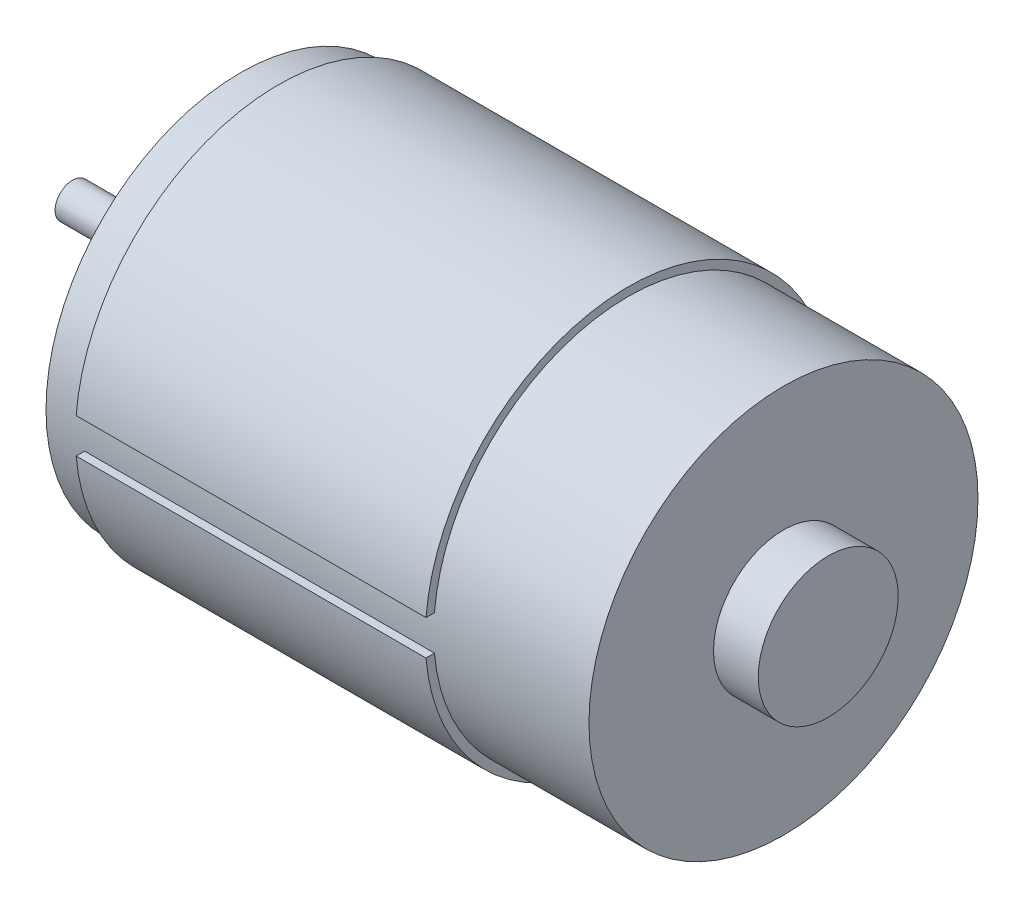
SolidWorks part; units mm, degrees
ref_plane "Front Plane" through (0, 0, 0) normal (0, 0, 1) x (1, 0, 0)
ref_plane "Top Plane" through (0, 0, 0) normal (0, 1, 0) x (1, 0, 0)
ref_plane "Right Plane" through (0, 0, 0) normal (1, 0, 0) x (0, 0, -1)
sketch "Sketch1" plane through (0, 0, 0) normal (0, 0, 1) x (1, 0, 0)
  line L0 (-8.1208, 0) -> (76.349, 0) construction
  line L1 (0, 0) -> (0, 1.25)
  line L2 (0, 1.25) -> (9.3, 1.25)
  line L3 (9.3, 1.25) -> (9.3, 5)
  line L4 (9.3, 5) -> (12, 5)
  line L5 (12, 5) -> (12, 13.9)
  line L6 (12, 13.9) -> (14.7, 13.9)
  line L7 (14.7, 13.9) -> (14.7, 14.5)
  line L8 (14.7, 14.5) -> (39.7, 14.5)
  line L9 (39.7, 14.5) -> (39.7, 13.9)
  line L10 (39.7, 13.9) -> (50.8, 13.9)
  line L11 (50.8, 13.9) -> (50.8, 5)
  line L12 (50.8, 5) -> (54, 5)
  line L13 (54, 5) -> (54, 0)
  line L14 (0, 0) -> (54, 0)
  dimension "D1" = 10
  dimension "D2" = 2.5
  dimension "D3" = 27.8
  dimension "D4" = 29
  dimension "D5" = 12
  dimension "D6" = 2.7
  dimension "D7" = 38.8
  dimension "D8" = 3.2
  dimension "D9" = 25
revolve "Revolve1" add sketch "Sketch1" angle 360 about L0
sketch "Sketch2" plane through (0, 0, 0) normal (1, 0, 0) x (0, 0, -1)
  line L0 (-13.8437, 1.25) -> (-17.2146, 1.25)
  line L1 (-17.2146, 1.25) -> (-17.2146, -1.25)
  line L2 (-18.1169, 0) -> (2.7494, 0) construction
  line L3 (-17.2146, -1.25) -> (-13.8437, -1.25)
  arc A0 (-13.8437, 1.25) -> (-13.8437, -1.25) centre (0, 0) ccw
  circle A1 centre (0, 0) radius 13.9 construction
  dimension "D1" = 2.5
extrude "Cut-Extrude1" cut sketch "Sketch2" along normal through all
